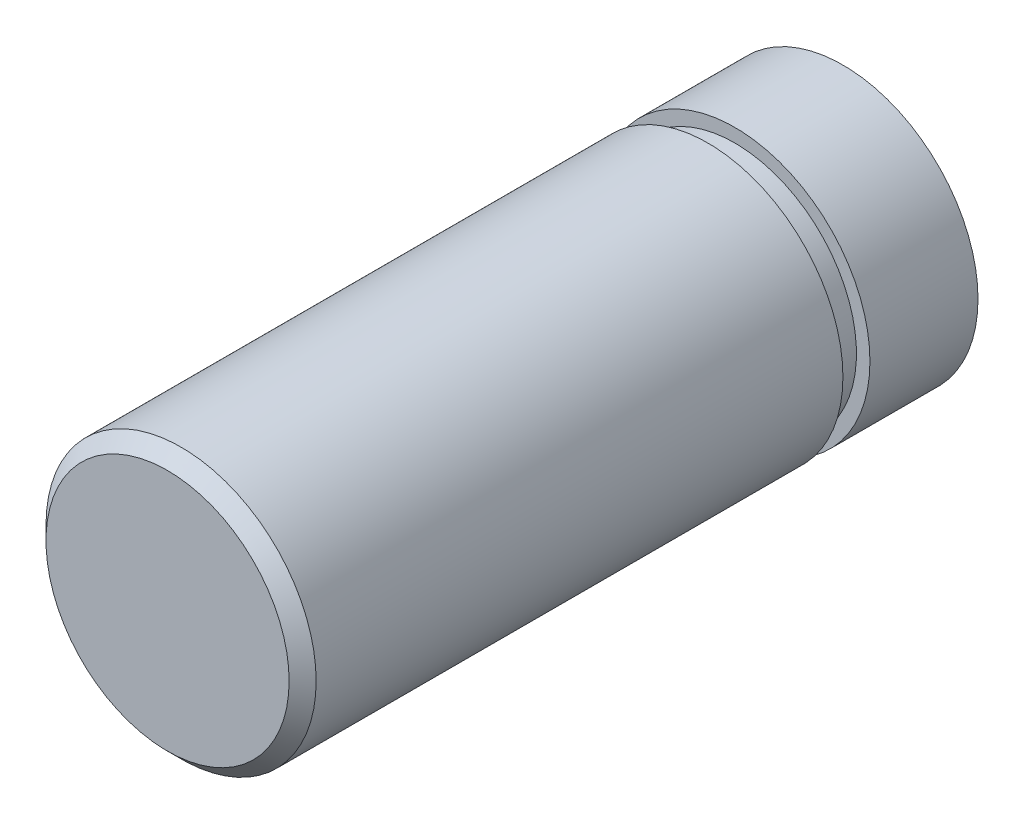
SolidWorks part; units mm, degrees
ref_plane "Plan de face" through (0, 0, 0) normal (0, 0, 1) x (1, 0, 0)
ref_plane "Plan de dessus" through (0, 0, 0) normal (0, 1, 0) x (1, 0, 0)
ref_plane "Plan de droite" through (0, 0, 0) normal (1, 0, 0) x (0, 0, -1)
sketch "Esquisse1" plane through (0, 0, 0) normal (0, 0, 1) x (1, 0, 0)
  circle A0 centre (0, 0) radius 10
  dimension "D1" = 20
extrude "Extrusion1" add sketch "Esquisse1" along normal blind 50
chamfer "Chanfrein1" distance 1 angle 45 1 edges at (10, 0, 50)
sketch "Esquisse2" plane through (0, 0, 0) normal (1, 0, 0) x (0, 0, -1)
  line L0 (0.5172, 0) -> (-50, 0) construction
  line L1 (-50, 9) -> (-50, -9) construction
  line L2 (0, 10) -> (-49, 10) construction
  line L3 (-8, 10) -> (-10, 10)
  line L4 (-8, 10) -> (-8, 9)
  line L5 (-8, 9) -> (-10, 9)
  line L6 (-10, 10) -> (-10, 9)
  dimension "D1" = 40
  dimension "D2" = 18
  dimension "D3" = 2
revolve "Enlèvement de matière-Révolution1" cut sketch "Esquisse2" angle 360 about L0
